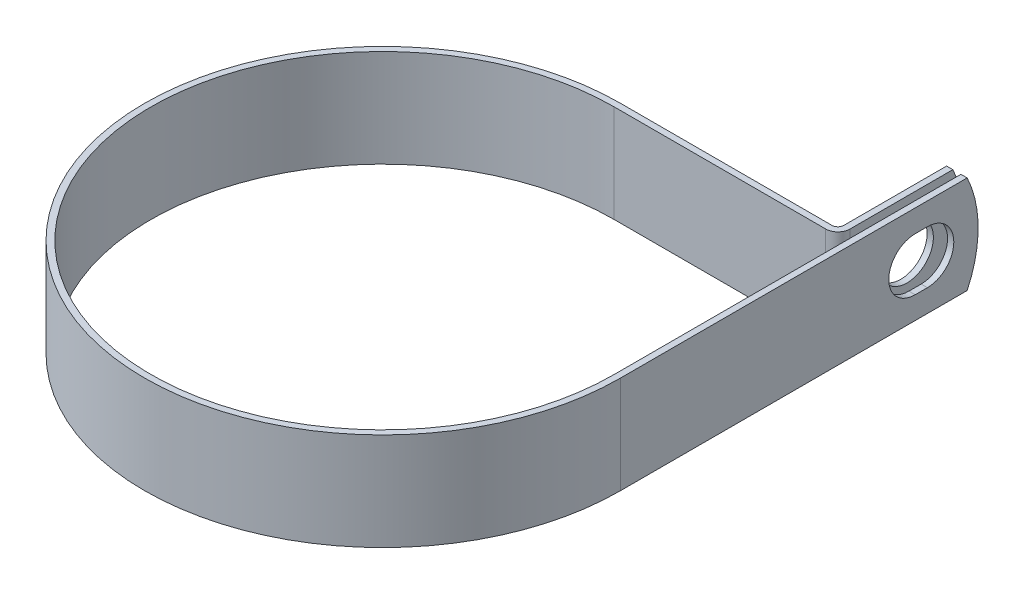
SolidWorks part; units mm, degrees
ref_plane "Front Plane" through (0, 0, 0) normal (0, 0, 1) x (1, 0, 0)
ref_plane "Top Plane" through (0, 0, 0) normal (0, 1, 0) x (1, 0, 0)
ref_plane "Right Plane" through (0, 0, 0) normal (1, 0, 0) x (0, 0, -1)
sketch "Sketch1" plane through (0, 0, 0) normal (0, 1, 0) x (1, 0, 0)
  line L0 (0, 45.2374) -> (41.2852, 45.2374)
  line L1 (45.2374, 0) -> (45.2374, 45.2374)
  line L2 (43.6626, 69.8246) -> (43.6626, 47.6148)
  line L5 (45.2374, 45.2374) -> (45.2374, 69.8246)
  arc A0 (0, 45.2374) -> (45.2374, 0) centre (0, 0) ccw
  arc A3 (41.2852, 45.2374) -> (43.6626, 47.6148) centre (41.2852, 47.6148) ccw
extrude "Extrude-Thin1" add sketch "Sketch1" along normal mid plane 19.05 thin
sketch "Sketch2" plane through (42.4434, 0, 0) normal (-1, 0, 0) x (0, 0, 1)
  line L0 (-69.8246, 9.525) -> (-69.8246, -9.525) construction
  line L7 (0, 9.525) -> (0, -9.525) construction
  circle A0 centre (-58.7248, 0) radius 5.1562
  point P2 (-69.8246, 0)
extrude "Cut-Extrude1" cut sketch "Sketch2" against normal up to surface (1.2192 mm away)
sketch "Sketch3" plane through (46.4566, 0, 0) normal (1, 0, 0) x (0, 0, -1)
  line L0 (57.531, 0) -> (59.9186, 0) construction
  line L1 (57.531, 5.1562) -> (59.9186, 5.1562)
  line L2 (57.531, -5.1562) -> (59.9186, -5.1562)
  line L3 (69.8246, 9.525) -> (69.8246, -9.525) construction
  arc A0 (57.531, 5.1562) -> (57.531, -5.1562) centre (57.531, 0) ccw
  arc A1 (59.9186, -5.1562) -> (59.9186, 5.1562) centre (59.9186, 0) ccw
  point P3 (58.7248, 0)
  point P8 (69.8246, 0)
  point P11 (52.3748, 0)
  point P12 (65.0748, 0)
extrude "Cut-Extrude2" cut sketch "Sketch3" against normal up to surface (1.2192 mm away)
sketch "Sketch4" plane through (42.4434, 0, 0) normal (-1, 0, 0) x (0, 0, 1)
  line L0 (-69.8246, 9.525) -> (-69.8246, -9.525)
  line L1 (-69.8246, 9.525) -> (-67.6801, 9.525)
  line L2 (-69.8246, 9.525) -> (-47.6148, 9.525) construction
  line L3 (-69.8246, -9.525) -> (-67.6801, -9.525)
  line L4 (-69.8246, -9.525) -> (-47.6148, -9.525) construction
  arc A0 (-67.6801, 9.525) -> (-67.6801, -9.525) centre (-47.5996, 0) ccw
extrude "Cut-Extrude3" cut sketch "Sketch4" against normal through all contours A0 M4 M5 | A0 L0 M2
equation "\"D1@Sketch3\" = \"D2@Sketch2\""
equation "\"D7@Sketch1\" = \"D3@Sketch2\" + \"D1@Sketch3\""
equation "\"D1@Sketch4\" = ( \"D1@Extrude-Thin1\" + .125 ) * 2"
equation "\"D2@Sketch1\"=1.95*\"D5@Extrude-Thin1\""
equation "\"D2@Sketch3\" = \"D1@Sketch2\""
